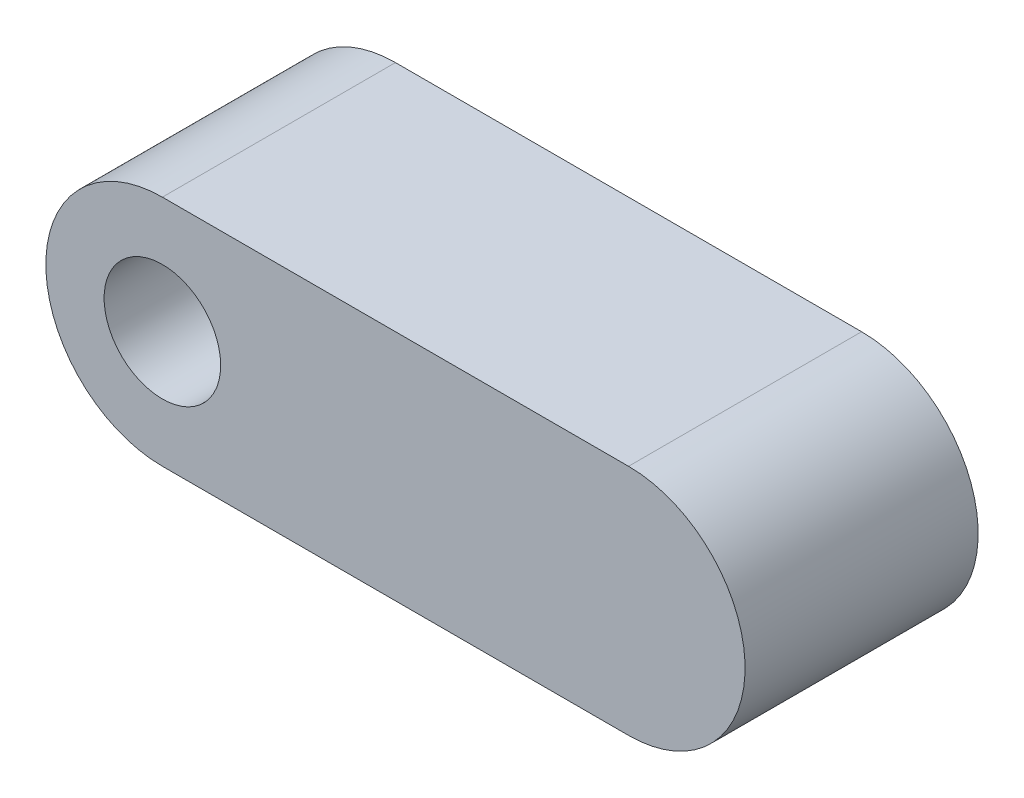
SolidWorks part; units mm, degrees
ref_plane "Face" through (0, 0, 0) normal (0, 0, 1) x (1, 0, 0)
ref_plane "Dessus" through (0, 0, 0) normal (0, 1, 0) x (1, 0, 0)
ref_plane "Droite" through (0, 0, 0) normal (1, 0, 0) x (0, 0, -1)
sketch "Esquisse1" plane through (0, 0, 0) normal (0, 0, 1) x (1, 0, 0)
  line L0 (0, 0) -> (4, 0) construction
  line L1 (0, 1) -> (4, 1)
  line L2 (0, -1) -> (4, -1)
  arc A0 (4, 1) -> (4, -1) centre (4, 0) cw
  circle A1 centre (0, 0) radius 0.5
  arc A2 (0, 1) -> (0, -1) centre (0, 0) ccw
  dimension "D3" = 1
  dimension "D1" = 2
  dimension "D2" = 4
extrude "Extrusion1" add sketch "Esquisse1" along normal mid plane 2
